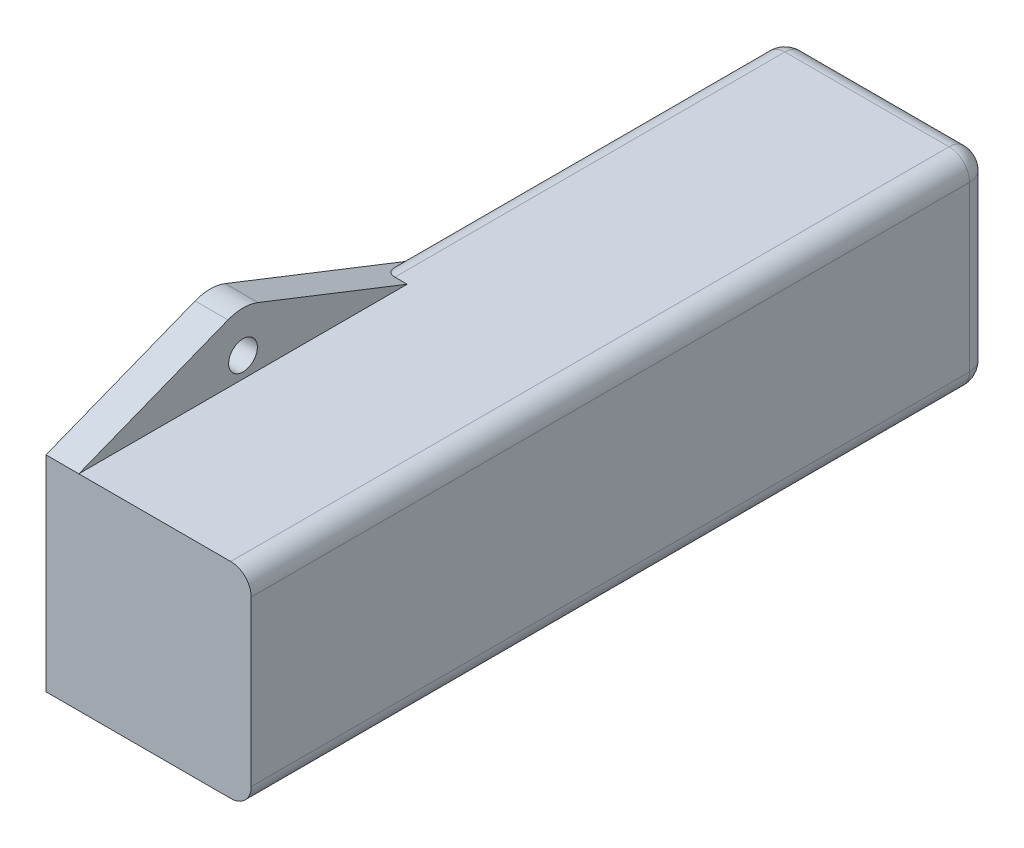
SolidWorks part; units mm, degrees
ref_plane "Plan de face" through (0, 0, 0) normal (0, 0, 1) x (1, 0, 0)
ref_plane "Plan de dessus" through (0, 0, 0) normal (0, 1, 0) x (1, 0, 0)
ref_plane "Plan de droite" through (0, 0, 0) normal (1, 0, 0) x (0, 0, -1)
sketch "Esquisse1" plane through (0, 0, 0) normal (1, 0, 0) x (0, 0, -1)
  line L1 (-45, -12.5) -> (45, -12.5)
  line L2 (-45, -12.5) -> (-45, 12.5)
  line L3 (-45, 12.5) -> (45, 12.5)
  line L4 (45, -12.5) -> (45, 12.5)
  point P4 (-45, 0)
  point P5 (0, 12.5)
  dimension "D1" = 25
  dimension "D2" = 90
extrude "Extrusion1" add sketch "Esquisse1" along normal blind 25
sketch "Esquisse2" plane through (0, 0, 0) normal (-1, 0, 0) x (0, 0, 1)
  line L0 (-32.27, 0) -> (45.7885, 0) construction
  line L2 (5, 12.5) -> (23.1684, 19.6525)
  line L3 (26.8316, 19.6525) -> (45, 12.5)
  line L4 (-45, 12.5) -> (45, 12.5) construction
  line L5 (26.8316, -19.6525) -> (45, -12.5)
  line L6 (5, -12.5) -> (23.1684, -19.6525)
  line L7 (5, 12.5) -> (5, -12.5)
  line L8 (45, 12.5) -> (45, -12.5)
  arc A0 (23.1684, 19.6525) -> (26.8316, 19.6525) centre (25, 15) cw
  arc A1 (23.1684, -19.6525) -> (26.8316, -19.6525) centre (25, -15) ccw
  circle A2 centre (25, 15) radius 1.75
  circle A3 centre (25, -15) radius 1.75
  dimension "D2" = 25
  dimension "D3" = 5
  dimension "D4" = 25
  dimension "D1" = 30
  dimension "D5" = 20
  dimension "D7" = 3.5
  dimension "D8" = 3.5
  dimension "D6" = 40
extrude "Extrusion2" add sketch "Esquisse2" against normal blind 4
fillet "Congé1" radius 2.5 8 edges at (0, -12.5, -20) (25, -12.5, 0) (0, 12.5, -20) (25, 12.5, 0) (12.5, -12.5, -45) (25, 0, -45) (12.5, 12.5, -45) (0, 0, -45)
